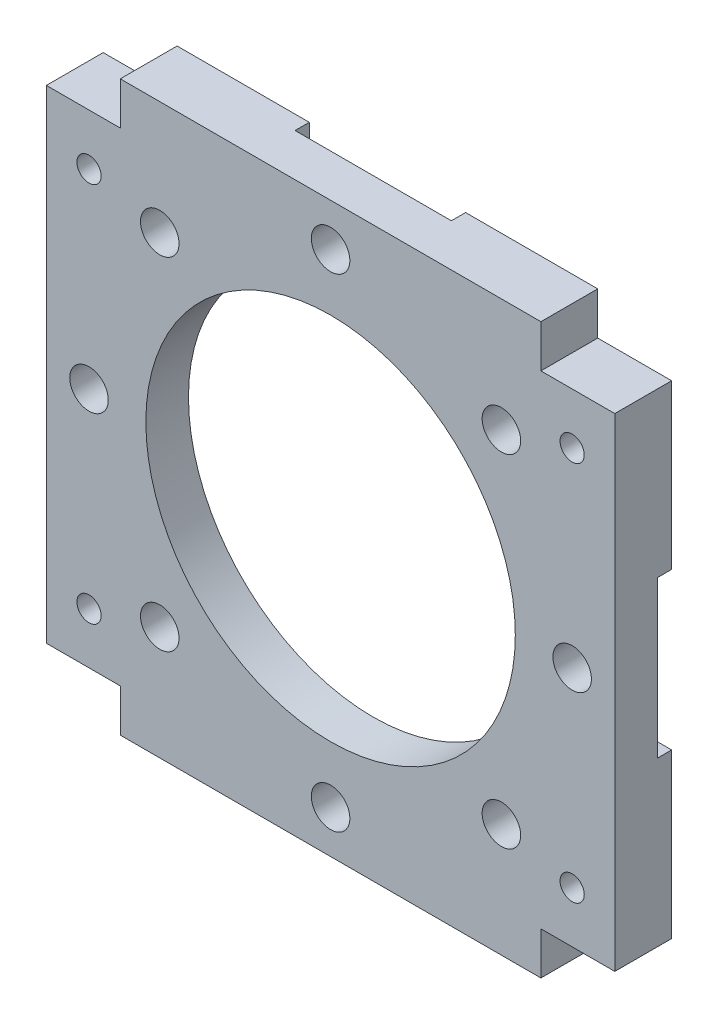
SolidWorks part; units mm, degrees
ref_plane "Front" through (0, 0, 0) normal (0, 0, 1) x (1, 0, 0)
ref_plane "Top" through (0, 0, 0) normal (0, 1, 0) x (1, 0, 0)
ref_plane "Right" through (0, 0, 0) normal (1, 0, 0) x (0, 0, -1)
sketch "Sketch1" plane through (0, 0, 0) normal (0, 0, 1) x (1, 0, 0)
  line L1 (31.75, -26.9875) -> (-31.75, -26.9875)
  line L3 (31.75, 26.9875) -> (31.75, -26.9875)
  line L6 (-31.75, -26.9875) -> (-31.75, 26.9875)
  line L7 (0, 0) -> (31.75, 0) construction
  line L8 (31.75, 26.9875) -> (-31.75, 26.9875)
  line L9 (0, 0) -> (0, 26.9875) construction
  circle A0 centre (0, 0) radius 30.1625 construction
  circle A1 centre (0, 0) radius 20.6375 construction
  circle A2 centre (0, 0) radius 20.6375 construction
  circle A4 centre (0, 0) radius 30.1625 construction
  dimension "D1" = 63.5
  dimension "D2" = 53.975
extrude "Extrude1" add sketch "Sketch1" along normal blind 4.7625 and the other way blind 1.5875
sketch "Sketch5" plane through (0, 0, 4.7625) normal (0, 0, 1) x (1, 0, 0)
  line L0 (31.75, 26.9875) -> (-31.75, 26.9875) construction
  line L1 (-23.495, 26.9875) -> (23.495, 26.9875)
  line L2 (-23.495, 26.9875) -> (-23.495, 31.75)
  line L3 (-23.495, 31.75) -> (23.495, 31.75)
  line L4 (23.495, 26.9875) -> (23.495, 31.75)
  line L5 (0, 0) -> (36.1956, 0) construction
  line L6 (23.495, -26.9875) -> (23.495, -31.75)
  line L7 (-23.495, -31.75) -> (23.495, -31.75)
  line L8 (-23.495, -26.9875) -> (-23.495, -31.75)
  line L9 (-23.495, -26.9875) -> (23.495, -26.9875)
  line L10 (-31.75, 26.9875) -> (-31.75, -26.9875) construction
  dimension "D3" = 4.7625
  dimension "D1" = 23.495
  dimension "D2" = 46.99
  dimension "D4" = 8.255
extrude "Extrude2" add sketch "Sketch5" against normal up to vertex (6.35 mm away)
sketch "Sketch2" plane through (0, 0, -1.5875) normal (0, 0, -1) x (-1, 0, 0)
  circle A0 centre (0, 0) radius 30.2133
  circle A1 centre (0, 0) radius 30.1625 construction
  circle A3 centre (0, 0) radius 20.6375
  circle A4 centre (0, 0) radius 30.1625 construction
  circle A5 centre (0, 0) radius 20.6375 construction
  dimension "D1" = 0.0508
extrude "Cut-Extrude1" cut sketch "Sketch2" against normal blind 1.5875
sketch "Sketch3" plane through (0, 0, -1.5875) normal (0, 0, -1) x (-1, 0, 0)
  circle A1 centre (0, 0) radius 20.6375
  circle A2 centre (0, 0) radius 20.6375
  dimension "D1" = 0
extrude "Cut-Extrude2" cut sketch "Sketch3" against normal through all
sketch "Sketch6" plane through (0, 0, 0) normal (0, 0, -1) x (-1, 0, 0)
  line L0 (8.7312, -8.7312) -> (8.7312, -38.1)
  line L1 (-8.7313, 38.1) -> (8.7312, 38.1)
  line L2 (-8.7313, 38.1) -> (-8.7313, 8.7312)
  line L3 (-8.7313, -38.1) -> (8.7312, -38.1)
  line L4 (8.7312, 38.1) -> (8.7312, 8.7312)
  line L5 (-38.1, 8.7312) -> (-8.7313, 8.7312)
  line L6 (-38.1, 8.7312) -> (-38.1, -8.7312)
  line L7 (-38.1, -8.7312) -> (-8.7312, -8.7312)
  line L8 (38.1, 8.7312) -> (38.1, -8.7312)
  line L9 (-8.7312, -8.7312) -> (-8.7313, -38.1)
  line L10 (8.7312, 8.7312) -> (38.1, 8.7312)
  line L11 (8.7312, -8.7312) -> (38.1, -8.7312)
  dimension "D1" = 17.4625
  dimension "D2" = 8.7312
  dimension "D3" = 38.1
  dimension "D4" = 8.7312
extrude "Cut-Extrude3" cut sketch "Sketch6" along normal blind 3.175
hole_wizard "#6-32 Tapped Hole1" positions "Sketch8" profile "Sketch7" tap size "#6-32" standard "Ansi Inch"
sketch "Sketch8" plane through (0, 0, 4.7625) normal (0, 0, 1) x (1, 0, 0)
  point P1 (26.9875, -21.2687)
  point P4 (-26.9875, -21.2687)
  point P7 (-26.9875, 21.2688)
  point P10 (26.9875, 21.2688)
sketch "Sketch7" plane through (26.9875, -21.2687, 4.7625) normal (1, 0, 0) x (0, -1, 0)
  line L0 (0, 0) -> (0, 6.35)
  line L1 (0, 6.35) -> (1.3525, 6.35)
  line L2 (1.3525, 6.35) -> (1.3525, 0)
  line L5 (1.3525, 0) -> (0, 0)
  line L11 (0, -6.35) -> (0, 107.95) construction
  dimension "Thru Tap Drill Dia." = 2.7051
  dimension "Thru Tap Drill Depth" = 6.35
hole_wizard "#18 (0.1695) Diameter Hole1" positions "Sketch10" profile "Sketch9" hole size "#18" standard "Ansi Inch"
sketch "Sketch10" plane through (0, 0, 0) normal (0, 0, -1) x (-1, 0, 0)
  line L0 (0, 0) -> (-19.083, 19.083)
  line L2 (0, 26.9875) -> (0, 0)
  circle A0 centre (0, 0) radius 26.9875
  point P0 (0, 26.9875)
  point P16 (19.083, 19.083)
  point P17 (26.9875, 0)
  point P18 (19.083, -19.083)
  point P19 (0, -26.9875)
  point P20 (-19.083, -19.083)
  point P21 (-26.9875, 0)
  point P22 (-19.083, 19.083)
  dimension "D1" = 26.9875
  dimension "D2" = 45
sketch "Sketch9" plane through (0, 26.9875, 0) normal (1, 0, 0) x (0, 1, 0)
  line L0 (0, 0) -> (0, 4.7626)
  line L1 (0, 4.7626) -> (2.1526, 4.7626)
  line L2 (2.1526, 4.7626) -> (2.1526, 0)
  line L5 (2.1526, 0) -> (0, 0)
  line L11 (0, -6.35) -> (0, 107.95) construction
  dimension "Thru Hole Dia." = 4.3053
  dimension "Thru Hole Depth" = 4.7626
equation "\"D2@Sketch5\" = \"D1@Sketch5\"*2"
equation "\"D2@Sketch6\" = \"D1@Sketch6\"/2"
equation "\"D4@Sketch6\" = \"D2@Sketch6\""
